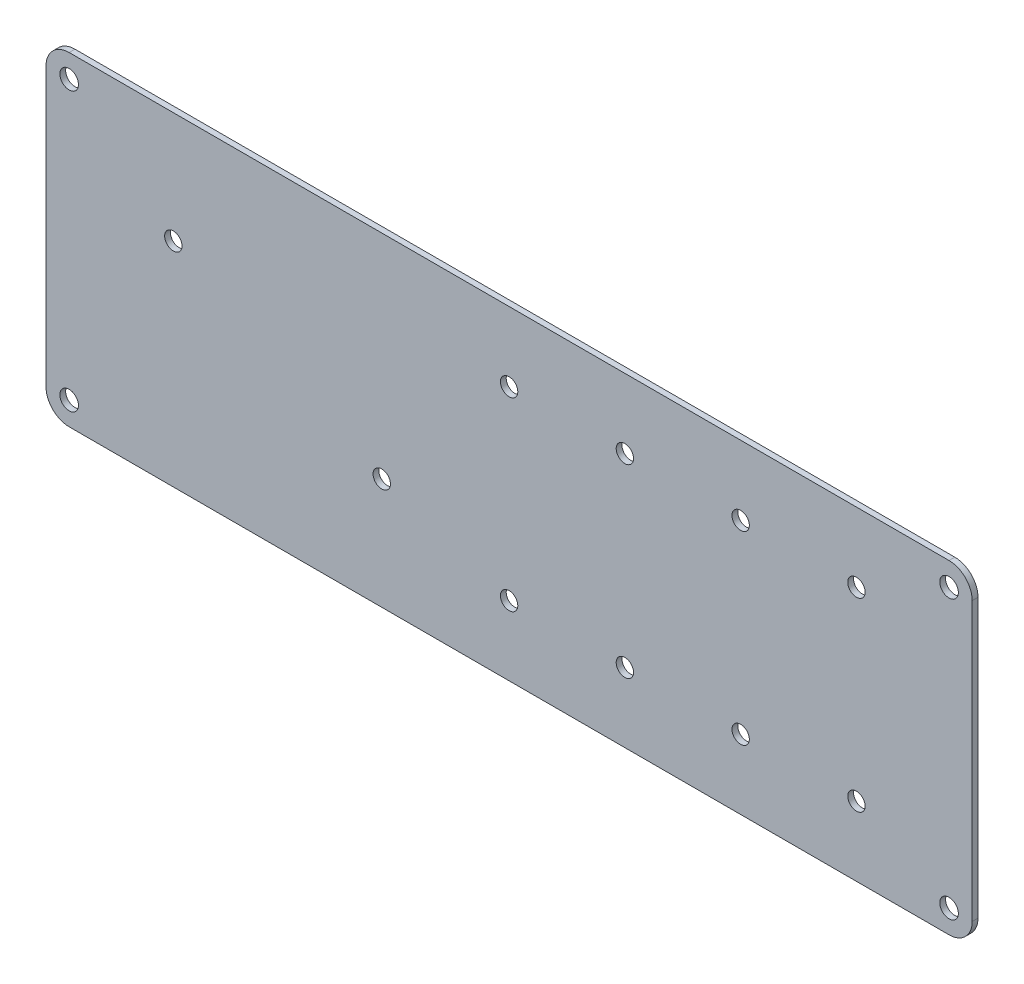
SolidWorks part; units mm, degrees
ref_plane "Front Plane" through (0, 0, 0) normal (0, 0, 1) x (1, 0, 0)
ref_plane "Top Plane" through (0, 0, 0) normal (0, 1, 0) x (1, 0, 0)
ref_plane "Right Plane" through (0, 0, 0) normal (1, 0, 0) x (0, 0, -1)
sketch "Sketch1" plane through (0, 0, 0) normal (0, 0, 1) x (1, 0, 0)
  line L1 (0, 0) -> (254, 0)
  line L2 (0, 0) -> (0, 88.9)
  line L3 (0, 88.9) -> (254, 88.9)
  line L4 (254, 0) -> (254, 88.9)
  dimension "D1" = 88.9
  dimension "D2" = 254
extrude "Boss-Extrude1" add sketch "Sketch1" along normal blind 1.5875
sketch "Sketch2" plane through (0, 0, 1.5875) normal (0, 0, 1) x (1, 0, 0)
  line L0 (0, 88.9) -> (0, 0) construction
  line L1 (254, 88.9) -> (0, 88.9) construction
  line L2 (0, 0) -> (254, 0) construction
  line L3 (254, 0) -> (254, 88.9) construction
  circle A0 centre (6.35, 82.55) radius 2.5527
  circle A1 centre (247.65, 82.55) radius 2.5527
  circle A2 centre (247.65, 6.35) radius 2.5527
  circle A3 centre (6.35, 6.35) radius 2.5527
  dimension "D5" = 5.1054
  dimension "D1" = 6.35
  dimension "D2" = 6.35
  dimension "D3" = 6.35
  dimension "D4" = 6.35
extrude "Cut-Extrude1" cut sketch "Sketch2" against normal through all
fillet "Fillet1" radius 6.35 4 edges at (254, 88.9, 0.7937) (254, 0, 0.7937) (0, 0, 0.7937) (0, 88.9, 0.7937)
sketch "Sketch3" plane through (0, 0, 0) normal (0, 0, -1) x (-1, 0, 0)
  line L0 (-254, 6.35) -> (-254, 82.55) construction
  line L1 (-6.35, 0) -> (-247.65, 0) construction
  circle A0 centre (-222.25, 19.05) radius 2.3813
  circle A1 centre (-190.5, 19.05) radius 2.3813
  circle A2 centre (-158.75, 19.05) radius 2.3813
  circle A3 centre (-127, 19.05) radius 2.3813
  circle A4 centre (-222.25, 69.85) radius 2.3813
  circle A5 centre (-190.5, 69.85) radius 2.3813
  circle A6 centre (-158.75, 69.85) radius 2.3813
  circle A7 centre (-127, 69.85) radius 2.3812
  dimension "D1" = 4.7625
  dimension "D2" = 31.75
  dimension "D3" = 19.05
  dimension "D5" = 31.75
  dimension "D7" = 50.8
  dimension "D4" = 4
  dimension "D6" = 2
extrude "Cut-Extrude2" cut sketch "Sketch3" against normal up to vertex (1.5875 mm away)
sketch "Sketch4" plane through (0, 0, 0) normal (0, 0, -1) x (-1, 0, 0)
  line L0 (-63.5, 88.9) -> (-63.5, 0) construction
  line L1 (-92.075, 58.42) -> (-34.925, 58.42) construction
  line L2 (-92.075, 58.42) -> (-92.075, 30.48) construction
  line L3 (-92.075, 30.48) -> (-34.925, 30.48) construction
  line L4 (-34.925, 58.42) -> (-34.925, 30.48) construction
  line L5 (-92.075, 58.42) -> (-34.925, 30.48) construction
  line L6 (-92.075, 30.48) -> (-34.925, 58.42) construction
  line L7 (-247.65, 88.9) -> (-6.35, 88.9) construction
  line L8 (-6.35, 0) -> (-247.65, 0) construction
  line L9 (0, 82.55) -> (0, 6.35) construction
  circle A1 centre (-34.925, 58.42) radius 2.3812
  circle A3 centre (-92.075, 30.48) radius 2.3813
  point P0 (-63.5, 44.45)
  dimension "D4" = 4.7625
  dimension "D1" = 27.94
  dimension "D2" = 57.15
  dimension "D3" = 63.5
extrude "Cut-Extrude3" cut sketch "Sketch4" against normal blind 3.175
